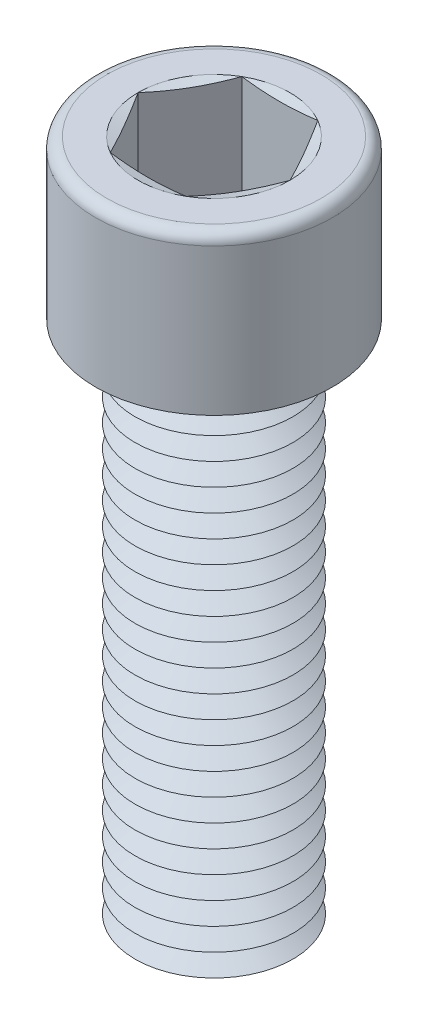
SolidWorks part; units mm, degrees
ref_plane "Front Plane" through (0, 0, 0) normal (0, 0, 1) x (1, 0, 0)
ref_plane "Top Plane" through (0, 0, 0) normal (0, 1, 0) x (1, 0, 0)
ref_plane "Right Plane" through (0, 0, 0) normal (1, 0, 0) x (0, 0, -1)
sketch "Sketch1" plane through (0, 0, 0) normal (0, 1, 0) x (1, 0, 0)
  circle A0 centre (0, 0) radius 6
  dimension "D1" = 12
extrude "Extrude1" add sketch "Sketch1" along normal blind 40
sketch "Sketch2" plane through (0, 40, 0) normal (0, 1, 0) x (1, 0, 0)
  circle A0 centre (0, 0) radius 9
  dimension "D1" = 18
extrude "Extrude2" add sketch "Sketch2" along normal blind 12
sketch "Sketch3" plane through (0, 52, 0) normal (0, 1, 0) x (1, 0, 0)
  line L1 (2.8868, 5) -> (-2.8868, 5)
  line L2 (-2.8868, 5) -> (-5.7735, 0)
  line L3 (-5.7735, 0) -> (-2.8868, -5)
  line L4 (-2.8868, -5) -> (2.8868, -5)
  line L5 (2.8868, -5) -> (5.7735, 0)
  line L6 (5.7735, 0) -> (2.8868, 5)
  circle A0 centre (0, 0) radius 5 construction
  dimension "D1" = 10
extrude "Extrude3" cut sketch "Sketch3" against normal blind 10
fillet "Fillet1" radius 0.85 1 edges at (0, 52, 9)
sketch "Sketch4" plane through (0, 0, 0) normal (1, 0, 0) x (0, 0, -1)
  line L0 (-5, 42) -> (0, 42)
  line L1 (0, 42) -> (0, 39.1132)
  line L2 (0, 39.1132) -> (-5, 42)
  dimension "D1" = 30
revolve "Cut-Revolve1" cut sketch "Sketch4" angle 360 about L1
sketch "Sketch5" plane through (0, 0, 0) normal (0, 0, 1) x (1, 0, 0)
  line L0 (-6, 0.85) -> (-6, -0.85)
  line L1 (-6, 40) -> (-6, 0) construction
  line L2 (-6, -0.85) -> (-4.5278, 0)
  line L3 (-6, 0) -> (6, 0) construction
  line L4 (-4.5278, 0) -> (-6, 0.85)
  dimension "D1" = 1.7
revolve "Cut-Revolve2" cut sketch "Sketch5" angle 360 about axis through (0, 40, 0) along (0, -1, 0)
pattern_linear "LPattern1" count 24 spacing 1.7 along (0, 1, 0) of "Cut-Revolve2"
sketch "Sketch6" plane through (0, 52, 0) normal (0, 1, 0) x (1, 0, 0)
  circle A0 centre (0, 0) radius 5.7735
extrude "Extrude4" cut sketch "Sketch6" against normal through all draft 75
